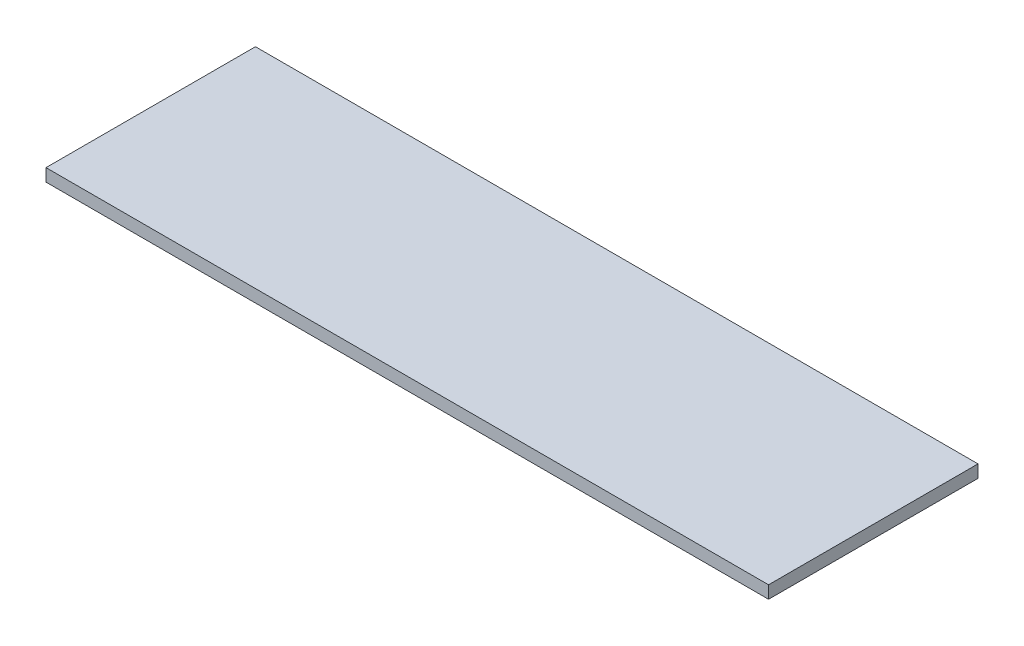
SolidWorks part; units mm, degrees
ref_plane "Front" through (0, 0, 0) normal (0, 0, 1) x (1, 0, 0)
ref_plane "Top" through (0, 0, 0) normal (0, 1, 0) x (1, 0, 0)
ref_plane "Right" through (0, 0, 0) normal (1, 0, 0) x (0, 0, -1)
sketch "Sketch1" plane through (0, 0, 0) normal (0, 1, 0) x (1, 0, 0)
  line L1 (-345, 100) -> (345, 100)
  line L2 (-345, 100) -> (-345, -100)
  line L3 (-345, -100) -> (345, -100)
  line L4 (345, 100) -> (345, -100)
  line L5 (-345, 100) -> (345, -100) construction
  line L6 (-345, -100) -> (345, 100) construction
  point P0 (0, 0)
  dimension "D1" = 690
  dimension "D2" = 200
extrude "Boss-Extrude1" add sketch "Sketch1" along normal blind 12
